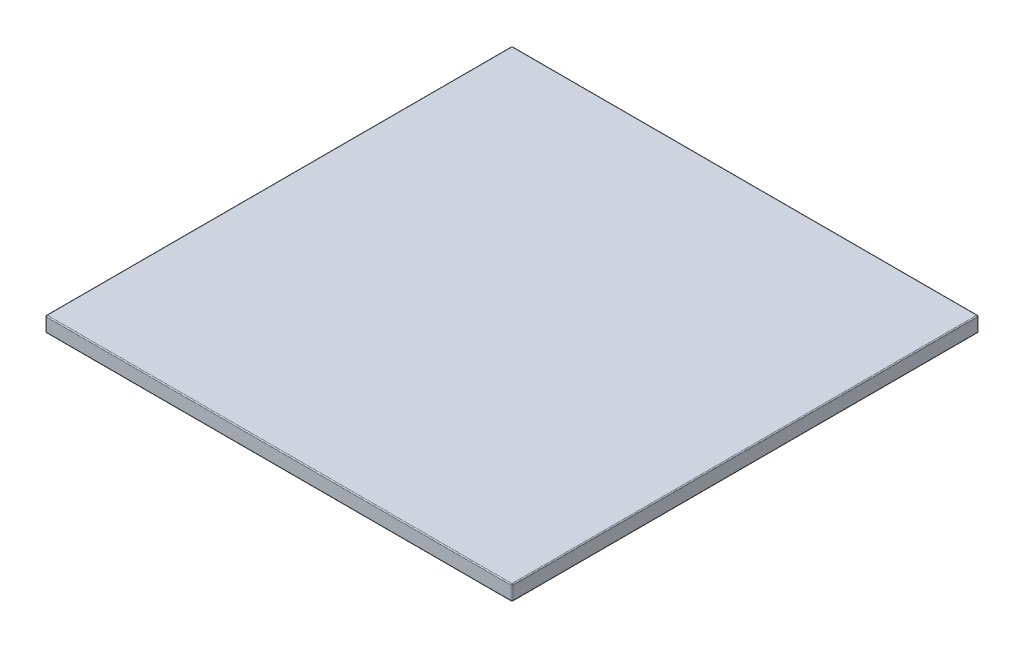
SolidWorks part; units mm, degrees
ref_plane "Front" through (0, 0, 0) normal (0, 0, 1) x (1, 0, 0)
ref_plane "Top" through (0, 0, 0) normal (0, 1, 0) x (1, 0, 0)
ref_plane "Right" through (0, 0, 0) normal (1, 0, 0) x (0, 0, -1)
sketch "Sketch1" plane through (0, 0, 0) normal (0, 1, 0) x (1, 0, 0)
  line L1 (0, 0) -> (1219.2, 0)
  line L2 (0, 0) -> (0, 1219.2)
  line L3 (0, 1219.2) -> (1219.2, 1219.2)
  line L4 (1219.2, 0) -> (1219.2, 1219.2)
  dimension "D1" = 1219.2
  dimension "D2" = 1219.2
extrude "Extrude1" add sketch "Sketch1" along normal blind 39.5
fillet "Fillet1" radius 2.54 12 edges at (1219.2, 19.75, -1219.2) (0, 19.75, -1219.2) (0, 19.75, 0) (1219.2, 19.75, 0) (609.6, 0, 0) (1219.2, 0, -609.6) (609.6, 0, -1219.2) (0, 0, -609.6) (609.6, 39.5, -1219.2) (1219.2, 39.5, -609.6) (609.6, 39.5, 0) (0, 39.5, -609.6)
